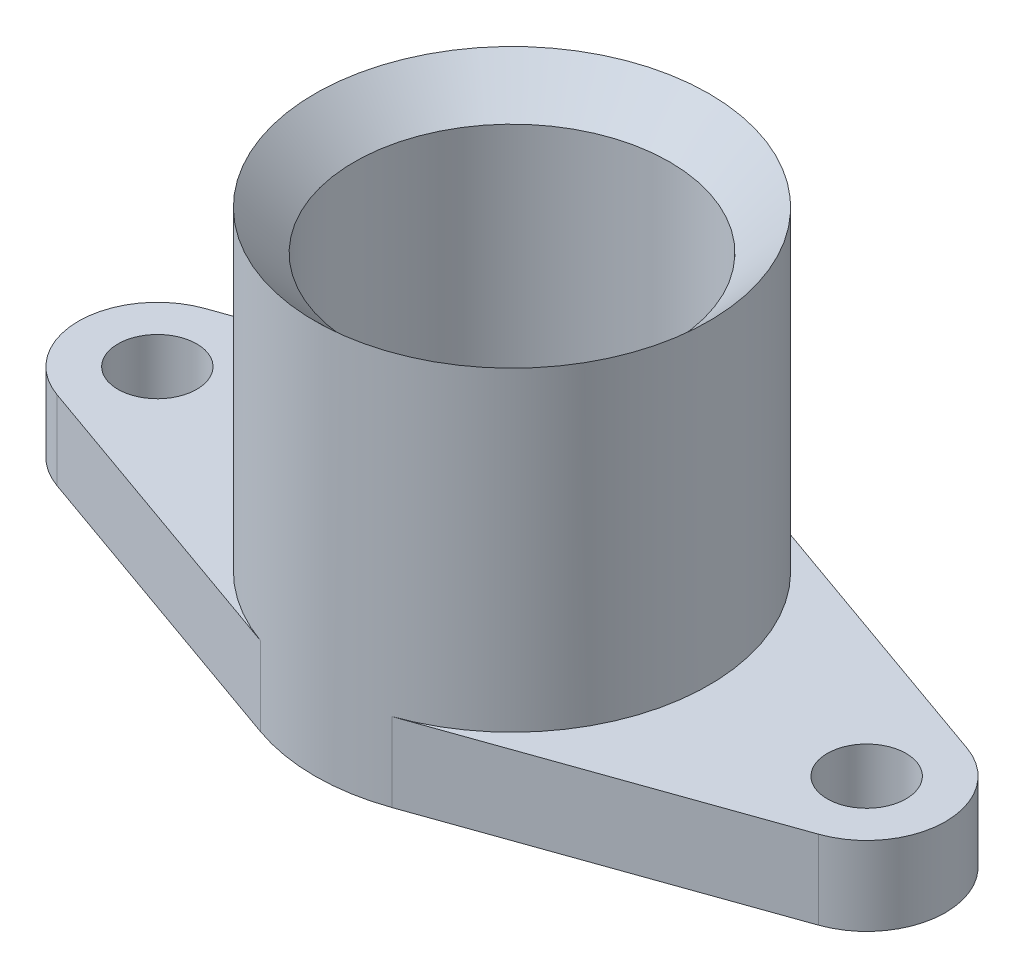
SolidWorks part; units mm, degrees
ref_plane "前视基准面" through (0, 0, 0) normal (0, 0, 1) x (1, 0, 0)
ref_plane "上视基准面" through (0, 0, 0) normal (0, 1, 0) x (1, 0, 0)
ref_plane "右视基准面" through (0, 0, 0) normal (1, 0, 0) x (0, 0, -1)
sketch "Sketch1" plane through (0, 0, 0) normal (0, 0, 1) x (1, 0, 0)
  line L0 (0, -73.0615) -> (0, 75.8716) construction
  line L1 (-50, 0) -> (-50, 100)
  line L2 (-50, 100) -> (-40, 90)
  line L3 (-40, 90) -> (-40, 0)
  line L4 (-40, 0) -> (-50, 0)
  line L5 (-122.4382, 0) -> (68.6457, 0) construction
  dimension "D1" = 80
  dimension "D2" = 100
  dimension "D3" = 90
  dimension "D4" = 100
revolve "Revolve1" add sketch "Sketch1" angle 360 about L0
sketch "Sketch2" plane through (0, 0, 0) normal (0, -1, 0) x (1, 0, 0)
  line L0 (-99.6024, 0) -> (89.2495, 0) construction
  line L1 (-16.6667, 47.1405) -> (-96.6667, 18.8562)
  line L2 (-16.6667, -47.1405) -> (-96.6667, -18.8562)
  circle A0 centre (-90, 0) radius 10
  arc A1 (-96.6667, 18.8562) -> (-96.6667, -18.8562) centre (-90, 0) ccw
  circle A2 centre (0, 0) radius 50 construction
  arc A3 (-16.6667, 47.1405) -> (-16.6667, -47.1405) centre (0, 0) ccw
  dimension "D1" = 40
  dimension "D2" = 20
  dimension "D3" = 90
extrude "Extrude1" add sketch "Sketch2" against normal blind 20
mirror "Mirror1" about plane through (0, 0, 0) normal (1, 0, 0) of "Extrude1"
